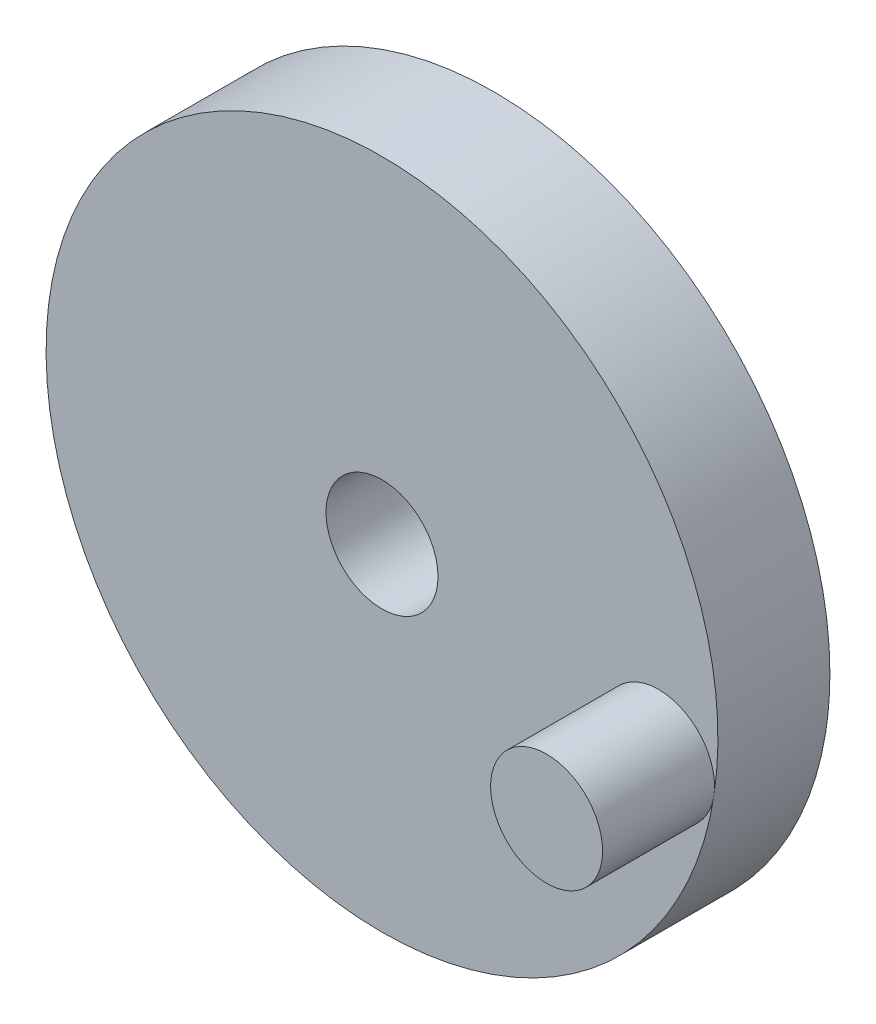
SolidWorks part; units mm, degrees
ref_plane "Front Plane" through (0, 0, 0) normal (0, 0, 1) x (1, 0, 0)
ref_plane "Top Plane" through (0, 0, 0) normal (0, 1, 0) x (1, 0, 0)
ref_plane "Right Plane" through (0, 0, 0) normal (1, 0, 0) x (0, 0, -1)
sketch "Sketch1" plane through (0, 0, 0) normal (0, 0, 1) x (1, 0, 0)
  circle A0 centre (0, 0) radius 30
  dimension "D1" = 60
extrude "Boss-Extrude1" add sketch "Sketch1" along normal blind 10
sketch "Sketch2" plane through (0, 0, 10) normal (0, 0, 1) x (1, 0, 0)
  circle A0 centre (0, 0) radius 5
  circle A1 centre (0, 0) radius 30 construction
  dimension "D1" = 10
extrude "Cut-Extrude1" cut sketch "Sketch2" against normal through all
sketch "Sketch5" plane through (0, 0, 10) normal (0, 0, 1) x (1, 0, 0)
  circle A0 centre (24.6988, -3.8692) radius 5
  circle A1 centre (0, 0) radius 30 construction
  dimension "D1" = 10
  dimension "D2" = 25
extrude "Boss-Extrude3" add sketch "Sketch5" along normal blind 10
